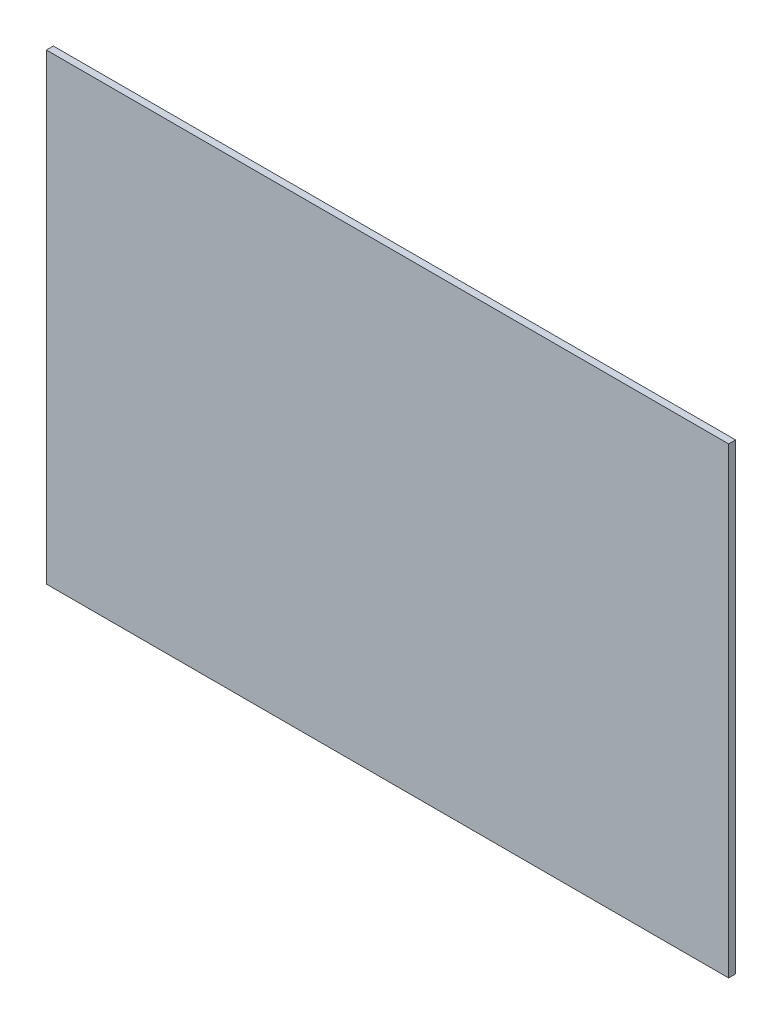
SolidWorks part; units mm, degrees
ref_plane "Front Plane" through (0, 0, 0) normal (0, 0, 1) x (1, 0, 0)
ref_plane "Top Plane" through (0, 0, 0) normal (0, 1, 0) x (1, 0, 0)
ref_plane "Right Plane" through (0, 0, 0) normal (1, 0, 0) x (0, 0, -1)
sketch "Sketch1" plane through (0, 0, 0) normal (0, 0, 1) x (1, 0, 0)
  line L1 (-147.5, 100) -> (147.5, 100)
  line L2 (-147.5, 100) -> (-147.5, -100)
  line L3 (-147.5, -100) -> (147.5, -100)
  line L4 (147.5, 100) -> (147.5, -100)
  line L5 (-147.5, 100) -> (147.5, -100) construction
  line L6 (-147.5, -100) -> (147.5, 100) construction
  point P0 (0, 0)
  dimension "D1" = 200
  dimension "D2" = 295
extrude "Boss-Extrude1" add sketch "Sketch1" along normal blind 3
